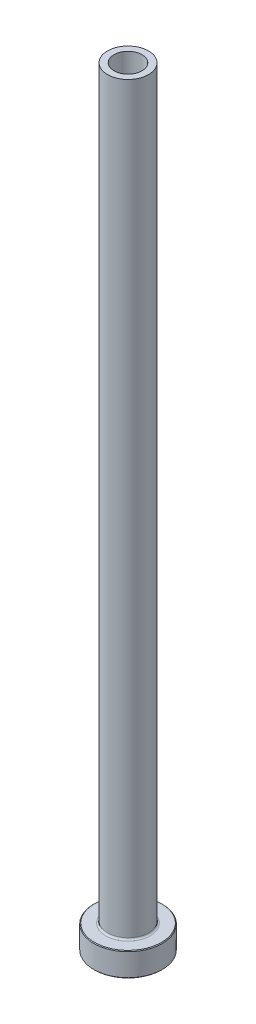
SolidWorks part; units mm, degrees
ref_plane "Front Plane" through (0, 0, 0) normal (0, 0, 1) x (1, 0, 0)
ref_plane "Top Plane" through (0, 0, 0) normal (0, 1, 0) x (1, 0, 0)
ref_plane "Right Plane" through (0, 0, 0) normal (1, 0, 0) x (0, 0, -1)
sketch "Sketch1" plane through (0, 0, 0) normal (0, 0, 1) x (1, 0, 0)
  line L0 (-4.1, 225) -> (-6, 225)
  line L1 (-6, 225) -> (-6, 7)
  line L2 (-6, 7) -> (-10, 7)
  line L3 (-10, 7) -> (-10, 0)
  line L4 (11, 0) -> (-11, 0) construction
  line L5 (-10, 0) -> (-4.35, 0)
  line L6 (-4.1, 180) -> (-4.1, 225)
  line L7 (0, 92.1877) -> (0, -15.5353) construction
  line L8 (0, -11) -> (0, 11) construction
  line L9 (-4.1, 180) -> (-4.35, 168)
  line L10 (-4.35, 168) -> (-4.35, 0)
  dimension "D1" = 0.25
  dimension "ID" = 8.2
  dimension "OD" = 12
  dimension "L" = 225
  dimension "H" = 20
  dimension "T" = 7
  dimension "N" = 45
  dimension "D2" = 12
revolve "Revolve1" add sketch "Sketch1" angle 360 about L7
fillet "Fillet1" radius 0.5 1 edges at (0, 7, 6)
chamfer "Chamfer1" distance 0.2 angle 45 2 edges at (0, 7, 10) (0, 0, 10)
chamfer "Chamfer3" distance 0.5 angle 45 1 edges at (0, 0, 4.35)
